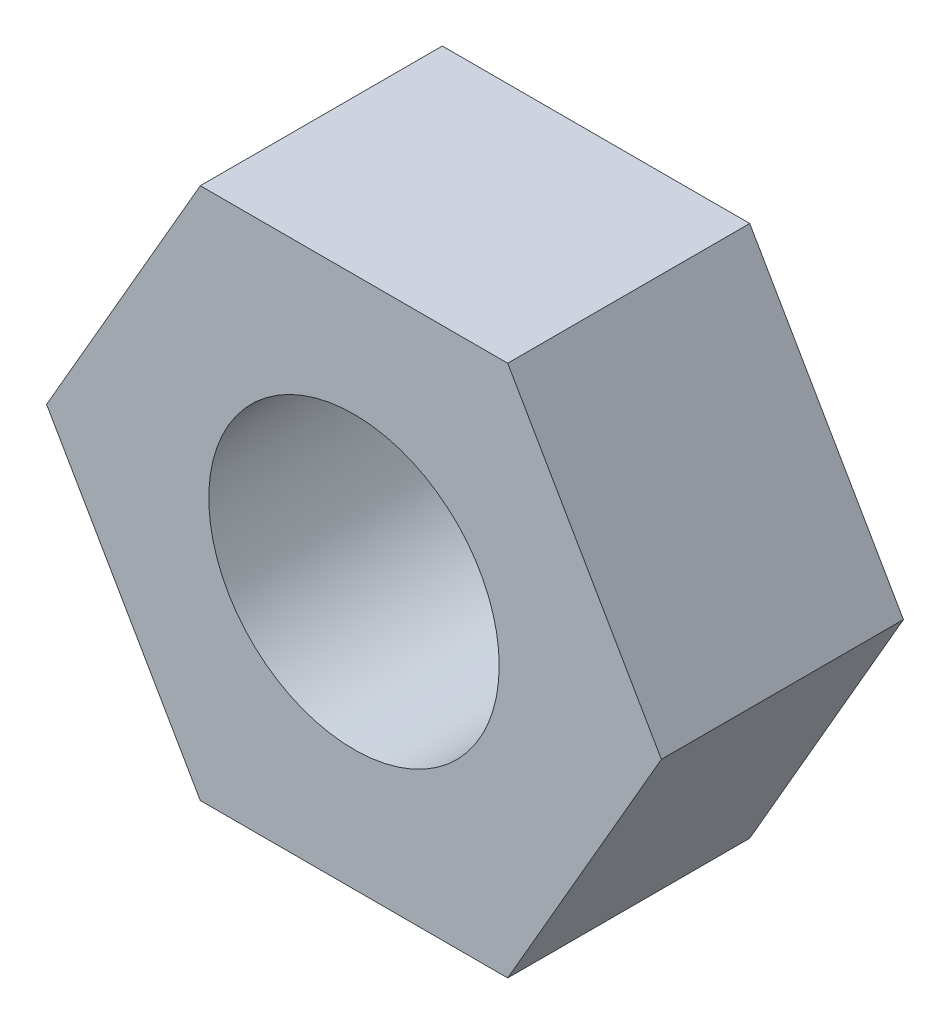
SolidWorks part; units mm, degrees
ref_plane "前视基准面" through (0, 0, 0) normal (0, 0, 1) x (1, 0, 0)
ref_plane "上视基准面" through (0, 0, 0) normal (0, 1, 0) x (1, 0, 0)
ref_plane "右视基准面" through (0, 0, 0) normal (1, 0, 0) x (0, 0, -1)
sketch "草图1" plane through (0, 0, 0) normal (0, 0, 1) x (1, 0, 0)
  line L1 (3.1754, 0) -> (1.5877, 2.75)
  line L2 (1.5877, 2.75) -> (-1.5877, 2.75)
  line L3 (-1.5877, 2.75) -> (-3.1754, 0)
  line L4 (-3.1754, 0) -> (-1.5877, -2.75)
  line L5 (-1.5877, -2.75) -> (1.5877, -2.75)
  line L6 (1.5877, -2.75) -> (3.1754, 0)
  circle A0 centre (0, 0) radius 2.75 construction
  circle A1 centre (0, 0) radius 1.5
  dimension "D1" = 3
  dimension "D2" = 5.5
extrude "凸台-拉伸1" add sketch "草图1" along normal blind 2.5
